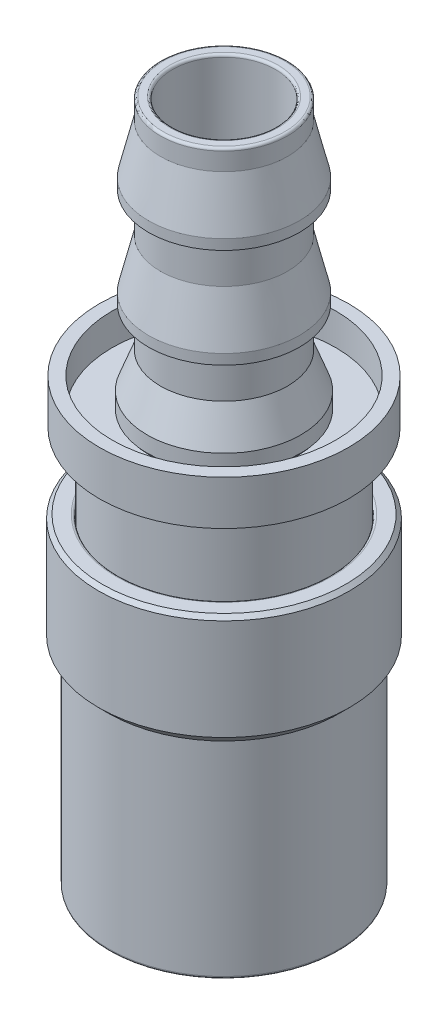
SolidWorks part; units mm, degrees
other "BODY_"
ref_plane "Front Plane" through (0, 0, 0) normal (0, 0, 1) x (1, 0, 0)
ref_plane "Top Plane" through (0, 0, 0) normal (0, 1, 0) x (1, 0, 0)
ref_plane "Right Plane" through (0, 0, 0) normal (1, 0, 0) x (0, 0, -1)
imported_body "SC200S"
imported_body "BODY"
imported_body "SLEEVE"
imported_body "PL-BARB"
sketch "Sketch1" plane through (0, 0, 0) normal (0, 0, 1) x (1, 0, 0)
  line L0 (-6.7437, 1.016) -> (-4.7625, 2.9972)
  line L1 (-4.7625, 2.9972) -> (-4.7625, 11.1863)
  line L2 (-4.7625, 11.1863) -> (-6.7437, 13.0794)
  line L3 (-6.7437, 13.0794) -> (-6.7437, 1.016)
  line L4 (0, 8.7926) -> (0, -2.6506) construction
  dimension "D1" = 9.525
revolve "Revolve1" add sketch "Sketch1" angle 360 about L4
sketch "Sketch2" plane through (0, 0, 0) normal (0, -1, 0) x (1, 0, 0)
  line L1 (6.477, -3.7395) -> (6.477, 3.7395)
  line L2 (6.477, 3.7395) -> (0, 7.479)
  line L3 (0, 7.479) -> (-6.477, 3.7395)
  line L4 (-6.477, 3.7395) -> (-6.477, -3.7395)
  line L5 (-6.477, -3.7395) -> (0, -7.479)
  line L6 (0, -7.479) -> (6.477, -3.7395)
  circle A0 centre (0, 0) radius 6.477 construction
  dimension "D1" = 12.954
extrude "Cut-Extrude1" cut sketch "Sketch2" against normal up to surface (15.5119 mm away)
